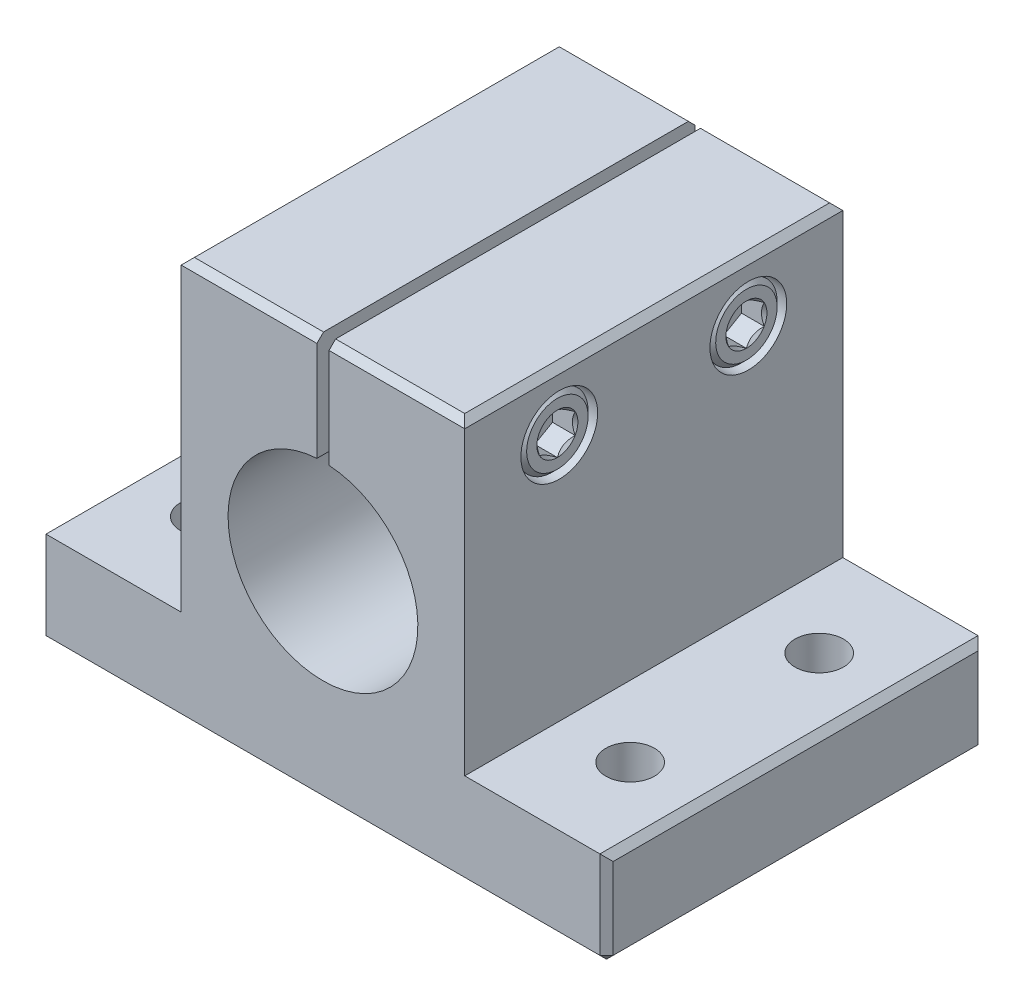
SolidWorks part; units mm, degrees
ref_plane "Front Plane" through (0, 0, 0) normal (0, 0, 1) x (1, 0, 0)
ref_plane "Top Plane" through (0, 0, 0) normal (0, 1, 0) x (1, 0, 0)
ref_plane "Right Plane" through (0, 0, 0) normal (1, 0, 0) x (0, 0, -1)
sketch "Sketch1" plane through (0, 0, 0) normal (0, 0, 1) x (1, 0, 0)
  line L0 (-38.1, 0) -> (38.1, 0)
  line L1 (-38.1, 0) -> (-38.1, 12.7)
  line L2 (-38.1, 12.7) -> (-19.05, 12.7)
  line L3 (-19.05, 12.7) -> (-19.05, 53.975)
  line L4 (-19.05, 53.975) -> (-0.8128, 53.975)
  line L5 (-0.8128, 53.975) -> (-0.8128, 39.7124)
  line L6 (0.8128, 39.7124) -> (0.8128, 53.975)
  line L7 (0.8128, 53.975) -> (19.05, 53.975)
  line L8 (19.05, 53.975) -> (19.05, 12.7)
  line L9 (19.05, 12.7) -> (38.1, 12.7)
  line L10 (38.1, 12.7) -> (38.1, 0)
  line L11 (0, 26.9875) -> (0, 0) construction
  arc A0 (-0.8128, 39.7124) -> (0.8128, 39.7124) centre (0, 26.9875) ccw
  circle A1 centre (0, 26.9875) radius 12.7508 construction
  dimension "D6" = 25.5016
  dimension "D1" = 76.2
  dimension "D2" = 12.7
  dimension "D3" = 53.975
  dimension "D4" = 38.1
  dimension "D5" = 26.9875
  dimension "D7" = 1.6256
extrude "Boss-Extrude1" add sketch "Sketch1" along normal mid plane 50.8
chamfer "Chamfer1" distance 0.889 angle 45 16 edges at (-38.1, 0, 0) (-38.1, 6.35, 25.4) (0, 0, 25.4) (-38.1, 6.35, -25.4) (0, 0, -25.4) (38.1, 6.35, -25.4) (38.1, 0, 0) (38.1, 6.35, 25.4) (-9.9314, 53.975, 25.4) (-19.05, 53.975, 0) (-9.9314, 53.975, -25.4) (9.9314, 53.975, -25.4) (19.05, 53.975, 0) (9.9314, 53.975, 25.4) (-38.1, 12.7, 0) (38.1, 12.7, 0)
sketch "Sketch2" plane through (0, 0, 0) normal (0, 1, 0) x (1, 0, 0)
  line L0 (-28.575, -12.7) -> (28.575, -12.7) construction
  line L1 (-28.575, 12.7) -> (28.575, 12.7) construction
  line L2 (0, -12.7) -> (0, 12.7) construction
  circle A0 centre (-28.575, -12.7) radius 3.2639
  circle A1 centre (28.575, -12.7) radius 3.2639
  circle A2 centre (-28.575, 12.7) radius 3.2639
  circle A3 centre (28.575, 12.7) radius 3.2639
  dimension "D2" = 6.5278
  dimension "D1" = 57.15
  dimension "D3" = 25.4
extrude "Cut-Extrude1" cut sketch "Sketch2" along normal through all
ref_plane "Plane1" through (0, 0, 12.7) normal (0, 0, 1) x (1, 0, 0)
sketch "Sketch3" plane through (0, 0, 12.7) normal (0, 0, 1) x (1, 0, 0)
  line L0 (19.05, 46.0248) -> (-19.05, 46.0248) construction
  line L1 (-19.05, 46.0248) -> (-19.05, 49.1998)
  line L2 (-19.05, 49.1998) -> (-1.27, 49.1998)
  line L3 (-1.27, 49.1998) -> (-1.27, 49.2887)
  line L4 (-1.27, 49.2887) -> (12.446, 49.2887)
  line L5 (12.446, 49.2887) -> (12.446, 51.181)
  line L6 (12.446, 51.181) -> (19.05, 51.181)
  line L8 (19.05, 51.181) -> (19.05, 46.0248)
  line L9 (0.8128, 53.975) -> (19.05, 53.975) construction
  line L10 (-19.05, 12.7) -> (-19.05, 53.975) construction
  line L11 (19.05, 53.975) -> (19.05, 12.7) construction
  line L12 (19.05, 46.0248) -> (-19.05, 46.0248)
  dimension "D1" = 7.9502
  dimension "D2" = 6.35
  dimension "D3" = 6.5278
  dimension "D4" = 20.32
  dimension "D5" = 6.604
  dimension "D6" = 10.3124
revolve "Cut-Revolve1" cut sketch "Sketch3" angle 360 mid plane about L0
sketch "Sketch4" plane through (0, 0, 12.7) normal (0, 0, 1) x (1, 0, 0)
  line L0 (18.796, 46.0248) -> (-12.954, 46.0248) construction
  line L1 (-12.954, 46.0248) -> (-12.954, 49.1998)
  line L2 (-12.954, 49.1998) -> (12.446, 49.1998)
  line L3 (12.446, 49.1998) -> (12.446, 50.6603)
  line L4 (12.573, 50.7873) -> (18.161, 50.7873)
  line L5 (18.796, 50.1523) -> (18.796, 46.0248)
  line L6 (18.796, 46.0248) -> (-12.954, 46.0248)
  line L7 (12.446, 50.6603) -> (12.573, 50.7873)
  line L8 (18.161, 50.7873) -> (18.796, 50.1523)
  line L10 (18.161, 50.7873) -> (18.796, 50.7873) construction
  line L11 (18.796, 50.7873) -> (18.796, 50.1523) construction
  line L12 (12.446, 50.6603) -> (12.446, 50.7873) construction
  line L13 (12.446, 50.7873) -> (12.573, 50.7873) construction
  dimension "D1" = 6.35
  dimension "D2" = 25.4
  dimension "D3" = 6.35
  dimension "D4" = 9.525
  dimension "D5" = 0.635
  dimension "D6" = 0.127
revolve "Revolve1" add sketch "Sketch4" angle 360 mid plane about L0
sketch "Sketch5" plane through (18.796, 0, 0) normal (1, 0, 0) x (0, 0, -1)
  line L1 (-12.7, 48.7818) -> (-15.0876, 47.4033)
  line L2 (-15.0876, 47.4033) -> (-15.0876, 44.6463)
  line L3 (-15.0876, 44.6463) -> (-12.7, 43.2678)
  line L4 (-12.7, 43.2678) -> (-10.3124, 44.6463)
  line L5 (-10.3124, 44.6463) -> (-10.3124, 47.4033)
  line L6 (-10.3124, 47.4033) -> (-12.7, 48.7818)
  circle A0 centre (-12.7, 46.0248) radius 2.3876 construction
  dimension "D1" = 4.7752
extrude "Cut-Extrude4" cut sketch "Sketch5" against normal blind 3.048
sketch "Sketch6" plane through (18.796, 0, 0) normal (1, 0, 0) x (0, 0, -1)
  circle A1 centre (-12.7, 46.0248) radius 2.757
extrude "Cut-Extrude5" cut sketch "Sketch6" against normal through all draft 45
mirror "Mirror1" about plane through (0, 0, 0) normal (0, 0, 1) of "Cut-Revolve1"
mirror "Mirror2" about plane through (0, 0, 0) normal (0, 0, 1)
